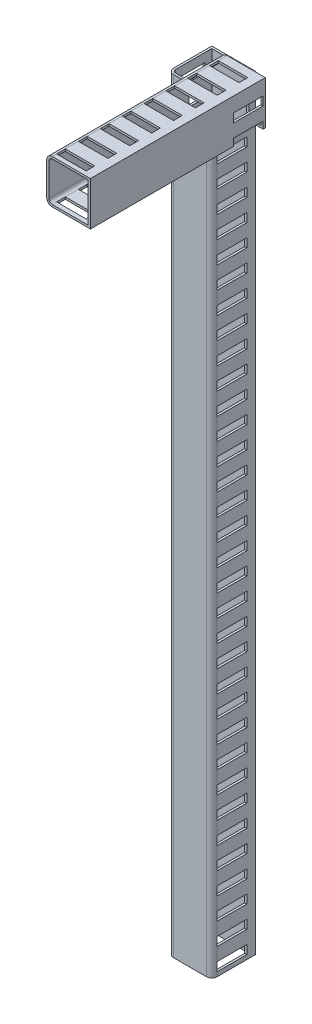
SolidWorks part; units mm, degrees
ref_plane "Front Plane" through (0, 0, 0) normal (0, 0, 1) x (1, 0, 0)
ref_plane "Top Plane" through (0, 0, 0) normal (0, 1, 0) x (1, 0, 0)
ref_plane "Right Plane" through (0, 0, 0) normal (1, 0, 0) x (0, 0, -1)
sketch "Sketch1" plane through (0, 0, 0) normal (0, 0, 1) x (1, 0, 0)
  line L1 (-69.9586, 279.4357) -> (-19.1586, 279.4357)
  line L2 (-69.9586, 279.4357) -> (-69.9586, -609.5643)
  line L3 (-69.9586, -609.5643) -> (-19.1586, -609.5643)
  line L4 (-19.1586, 279.4357) -> (-19.1586, -609.5643)
  dimension "D1" = 889
  dimension "D2" = 50.8
  dimension "D3" = 19.1586
  dimension "D4" = 279.4357
extrude "Boss-Extrude1" add sketch "Sketch1" along normal blind 50.8
ref_plane "Plane1" through (-0.1086, 0, 0) normal (1, 0, 0) x (0, 0, -1)
sketch "Sketch2" plane through (-0.1086, 0, 0) normal (-1, 0, 0) x (0, 0, 1)
  line L0 (3.0697, 113.4364) -> (3.0697, 138.8364) construction
  line L1 (210.8671, 286.4007) -> (7.6671, 286.4007)
  line L2 (210.8671, 286.4007) -> (210.8671, 235.6007)
  line L3 (210.8671, 235.6007) -> (7.6671, 235.6007)
  line L4 (7.6671, 286.4007) -> (7.6671, 235.6007)
  dimension "D1" = 50.8
  dimension "D2" = 203.2
  dimension "D3" = 4.5974
  dimension "D4" = 96.7643
extrude "Boss-Extrude2" add sketch "Sketch2" along normal blind 50.8
fillet "Fillet1" radius 6.35 4 edges at (-19.1586, -186.9818, 50.8) (-69.9586, -165.0643, 50.8) (-50.9086, 235.6007, 130.8336) (-50.9086, 286.4007, 109.2671)
shell "Shell1" thickness 2.54
sketch "Sketch3" plane through (-69.9586, 0, 0) normal (-1, 0, 0) x (0, 0, 1)
  line L0 (0, 279.4357) -> (0, -609.5643) construction
  line L1 (10.16, -594.3243) -> (44.45, -594.3243)
  line L2 (10.16, -594.3243) -> (10.16, -604.4843)
  line L3 (10.16, -604.4843) -> (44.45, -604.4843)
  line L4 (44.45, -594.3243) -> (44.45, -604.4843)
  line L5 (44.45, -609.5643) -> (0, -609.5643) construction
  dimension "D1" = 10.16
  dimension "D2" = 34.29
  dimension "D3" = 10.16
  dimension "D4" = 5.08
extrude "Cut-Extrude1" cut sketch "Sketch3" against normal through all both and the other way through all
pattern_linear "LPattern1" count 35 spacing 25.4 along (0, 1, 0) of "Cut-Extrude1"
sketch "Sketch4" plane through (0, 235.6007, 0) normal (0, -1, 0) x (1, 0, 0)
  line L0 (-44.5586, 210.8671) -> (-0.1086, 210.8671) construction
  line L1 (-44.5586, 195.6271) -> (-10.2686, 195.6271)
  line L2 (-44.5586, 195.6271) -> (-44.5586, 205.7871)
  line L3 (-44.5586, 205.7871) -> (-10.2686, 205.7871)
  line L4 (-10.2686, 195.6271) -> (-10.2686, 205.7871)
  line L5 (-0.1086, 7.6671) -> (-0.1086, 10.16) construction
  dimension "D1" = 10.16
  dimension "D2" = 34.29
  dimension "D3" = 5.08
  dimension "D4" = 10.16
extrude "Cut-Extrude2" cut sketch "Sketch4" against normal through all
pattern_linear "LPattern2" count 8 spacing 25.4 along (0, 0, -1) of "Cut-Extrude2"
